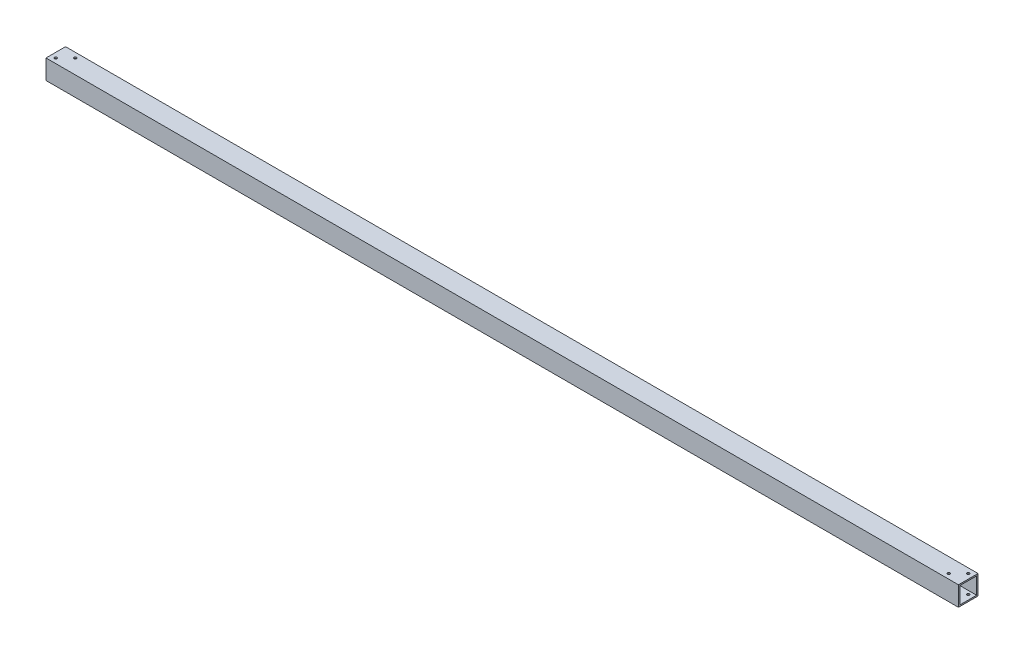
SolidWorks part; units mm, degrees
ref_plane "Front" through (0, 0, 0) normal (0, 0, 1) x (1, 0, 0)
ref_plane "Top" through (0, 0, 0) normal (0, 1, 0) x (1, 0, 0)
ref_plane "Right" through (0, 0, 0) normal (1, 0, 0) x (0, 0, -1)
sketch "Sketch1" plane through (0, 0, 0) normal (1, 0, 0) x (0, 0, -1)
  line L1 (0, 0) -> (50.8, 0)
  line L2 (0, 0) -> (0, 50.8)
  line L3 (0, 50.8) -> (50.8, 50.8)
  line L4 (50.8, 0) -> (50.8, 50.8)
  line L5 (3.6576, 47.1424) -> (47.1424, 47.1424)
  line L6 (3.6576, 47.1424) -> (3.6576, 3.6576)
  line L7 (3.6576, 3.6576) -> (47.1424, 3.6576)
  line L8 (47.1424, 47.1424) -> (47.1424, 3.6576)
  dimension "D1" = 50.8
  dimension "D2" = 50.8
  dimension "D3" = 3.6576
  dimension "D4" = 3.6576
  dimension "D5" = 3.6576
  dimension "D6" = 3.6576
extrude "Extrude1" add sketch "Sketch1" along normal blind 2370.582
sketch "Sketch3" plane through (0, 50.8, 0) normal (0, 1, 0) x (1, 0, 0)
  line L0 (0, 50.8) -> (0, 0) construction
  line L1 (0, 25.4) -> (2370.582, 25.4) construction
  line L2 (2370.582, 50.8) -> (2370.582, 0) construction
  circle A0 centre (12.7, 12.7) radius 3.3731
  circle A1 centre (38.1, 38.1) radius 3.3731
  circle A2 centre (2357.882, 38.1) radius 3.3731
  circle A3 centre (2332.482, 12.7) radius 3.3731
  dimension "D1" = 6.7462
  dimension "D7" = 25.4
  dimension "D8" = 12.7
  dimension "D9" = 12.7
  dimension "D2" = 12.7
  dimension "D3" = 38.1
  dimension "D4" = 12.7
  dimension "D5" = 25.4
  dimension "D6" = 12.7
extrude "Cut-Extrude1" cut sketch "Sketch3" against normal through all
